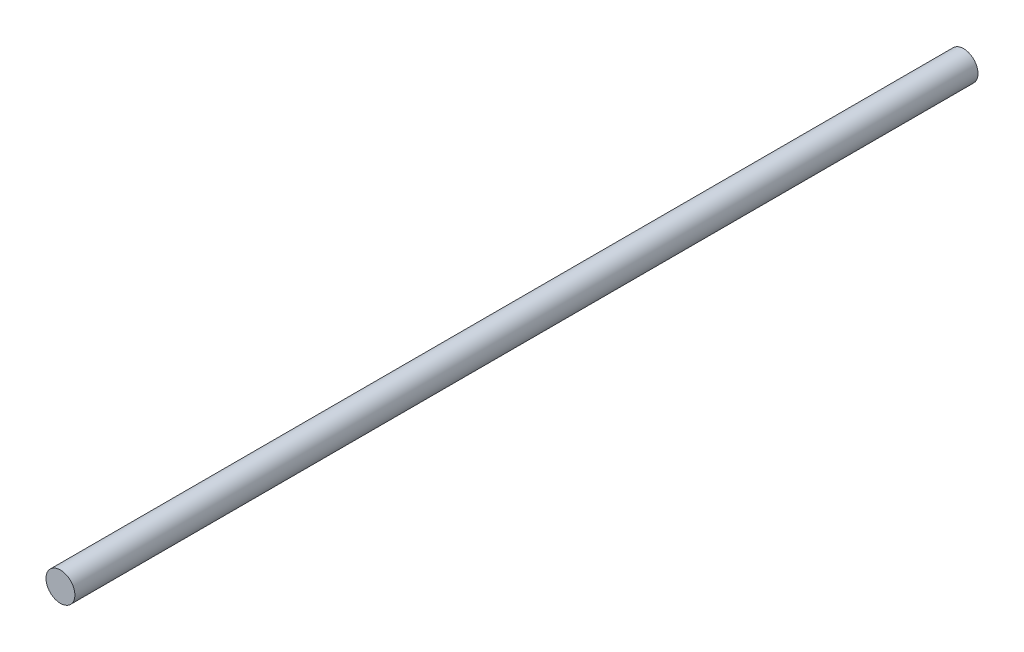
SolidWorks part; units mm, degrees
ref_plane "Face" through (0, 0, 0) normal (0, 0, 1) x (1, 0, 0)
ref_plane "Dessus" through (0, 0, 0) normal (0, 1, 0) x (1, 0, 0)
ref_plane "Droite" through (0, 0, 0) normal (1, 0, 0) x (0, 0, -1)
sketch "Esquisse1" plane through (0, 0, 0) normal (0, 0, 1) x (1, 0, 0)
  circle A0 centre (0, 0) radius 0.4
  dimension "D1" = 0.8
extrude "Extrusion1" add sketch "Esquisse1" along normal blind 25
